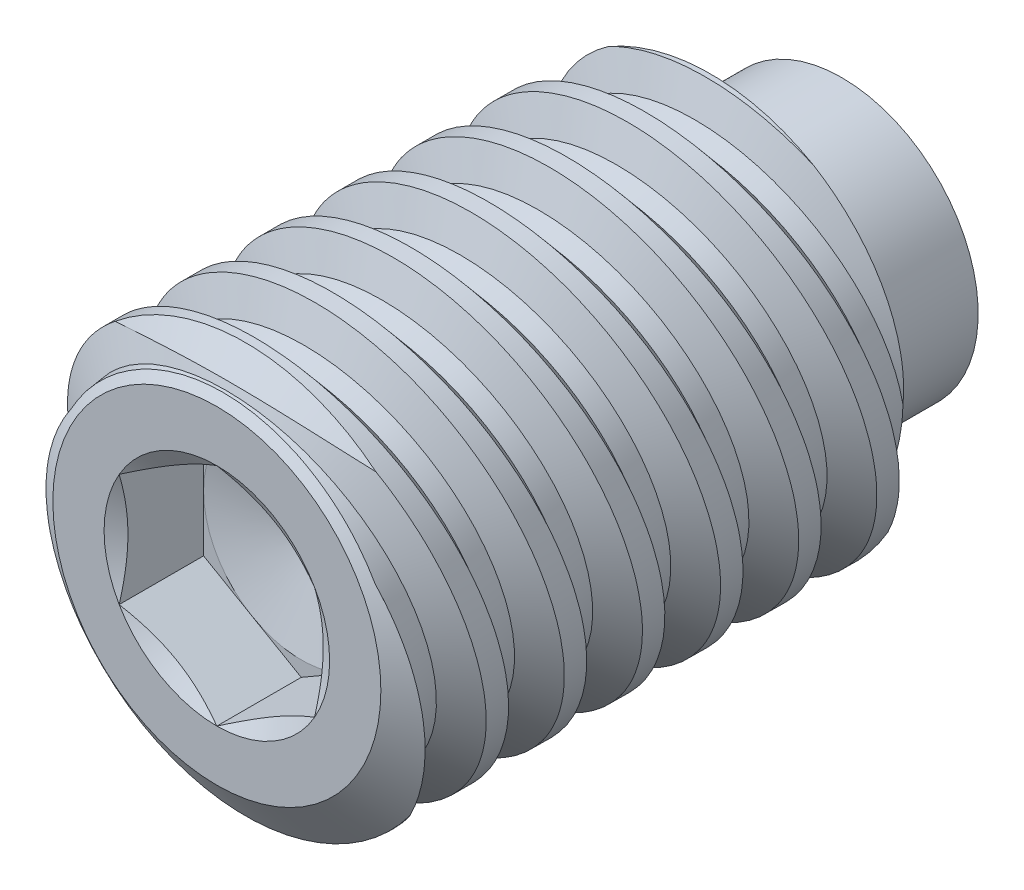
SolidWorks part; units mm, degrees
ref_plane "Front" through (0, 0, 0) normal (0, 0, 1) x (1, 0, 0)
ref_plane "Top" through (0, 0, 0) normal (0, 1, 0) x (1, 0, 0)
ref_plane "Right" through (0, 0, 0) normal (1, 0, 0) x (0, 0, -1)
sketch "Sketch22" plane through (0, 0, 0) normal (1, 0, 0) x (0, 0, -1)
  line L0 (-3.175, 0) -> (-3.175, 1.6662)
  line L1 (-3.175, 1.6662) -> (-2.8833, 2.0828)
  line L2 (-2.8833, 2.0828) -> (1.8423, 2.0828)
  line L3 (3.175, 0) -> (3.175, 1.3843)
  line L5 (3.175, 0) -> (-3.175, 0)
  line L6 (3.6835, 0) -> (3.175, 0) construction
  line L7 (3.175, 1.3843) -> (2.0828, 1.3843)
  line L11 (-2.8833, -2.0828) -> (1.8423, -2.0828) construction
  line L13 (2.0828, 1.3843) -> (2.0828, 1.6662)
  line L14 (2.0828, 1.6662) -> (1.8423, 2.0828)
  line L15 (-3.175, 1.6662) -> (2.0828, 1.6662) construction
  dimension "D1" = 5.0173
  dimension "Screw Dia" = 4.1656
  dimension "D2" = 60
  dimension "Length" = 6.35
  dimension "D3" = 35
  dimension "D7" = 3.3325
  dimension "Tip Dia" = 2.7686
  dimension "Tip Length" = 1.0922
revolve "Revolve1" add sketch "Sketch22" angle 360 about L6
sketch "Sketch6" plane through (0, 0, 0) normal (1, 0, 0) x (0, 0, -1)
  line L0 (1.0626, 2.0828) -> (1.8563, -2.0828) construction
  line L1 (-2.8833, 2.0828) -> (1.8423, 2.0828) construction
  line L2 (1.8423, 2.0828) -> (1.8423, 2.2314) construction
  line L3 (1.0626, 2.0828) -> (1.16, 2.1014) construction
  line L4 (1.6791, 1.7629) -> (1.4841, 1.7258)
  line L5 (1.4841, 1.7258) -> (1.16, 2.1014)
  line L6 (1.6791, 1.7629) -> (1.8423, 2.2314)
  line L7 (1.8423, 2.2314) -> (1.16, 2.1014)
  line L8 (1.5171, 2.0828) -> (2.3108, -2.0828) construction
  line L9 (2.7654, 0.1622) -> (1.0626, -0.1622) construction
  line L10 (1.5012, 2.1664) -> (1.5816, 1.7443) construction
  line L13 (1.0626, -2.0828) -> (1.0626, 2.0828) construction
  line L14 (1.0626, -2.0828) -> (1.8563, -2.0828) construction
  line L15 (1.8563, -2.0828) -> (2.3108, -2.0828) construction
  line L16 (-2.8833, -2.0828) -> (1.8423, -2.0828) construction
  line L18 (1.0626, 2.0828) -> (1.5171, 2.0828) construction
  point P18 (1.914, 0)
  dimension "D1" = 0.7937
  dimension "D2" = 0.1984
  dimension "D3" = 60
  dimension "D4" = 0.0992
  dimension "Pitch" = 0.7937
revolve "Cut-Revolve8" cut sketch "Sketch6" angle 360 about L9
pattern_linear "LPattern1" count 7 spacing 0.7937 along (0, 0, 1) count 2 spacing 0.7937 along (0, 0, 1) of "Cut-Revolve8"
sketch "Sketch23" plane through (0, 0, 3.175) normal (0, 0, 1) x (1, 0, 0)
  line L1 (0, 1.1457) -> (-0.9922, 0.5728)
  line L2 (-0.9922, 0.5728) -> (-0.9922, -0.5728)
  line L3 (-0.9922, -0.5728) -> (0, -1.1457)
  line L4 (0, -1.1457) -> (0.9922, -0.5728)
  line L5 (0.9922, -0.5728) -> (0.9922, 0.5728)
  line L6 (0.9922, 0.5728) -> (0, 1.1457)
  circle A0 centre (0, 0) radius 0.9922 construction
  dimension "Hex" = 1.9844
extrude "Cut-Extrude10" cut sketch "Sketch23" against normal blind 0.8573
sketch "Sketch24" plane through (0, 0, 3.175) normal (0, 0, 1) x (1, 0, 0)
  circle A0 centre (0, 0) radius 1.1457
extrude "Cut-Extrude11" cut sketch "Sketch24" against normal through all draft 60
sketch "Sketch26" plane through (0, 0, 2.3177) normal (0, 0, 1) x (1, 0, 0)
  circle A0 centre (0, 0) radius 0.9922 construction
  circle A1 centre (0, 0) radius 0.9922
extrude "Cut-Extrude12" cut sketch "Sketch26" against normal through all draft 75
equation "\"D2@Sketch6\"=\"Pitch@Sketch6\"/4"
equation "\"D4@Sketch6\"=\"Pitch@Sketch6\"/8"
equation "\"D1@Sketch6\"=\"Pitch@Sketch6\""
equation "\"D3@LPattern1\"=\"Pitch@Sketch6\""
equation "\"D1@LPattern1\"=(\"D1@Sketch22\"/\"Pitch@Sketch6\")+1"
equation "\"D4@LPattern1\"=\"Pitch@Sketch6\""
equation "\"D7@Sketch22\"=\"Screw Dia@Sketch22\"*.8"
